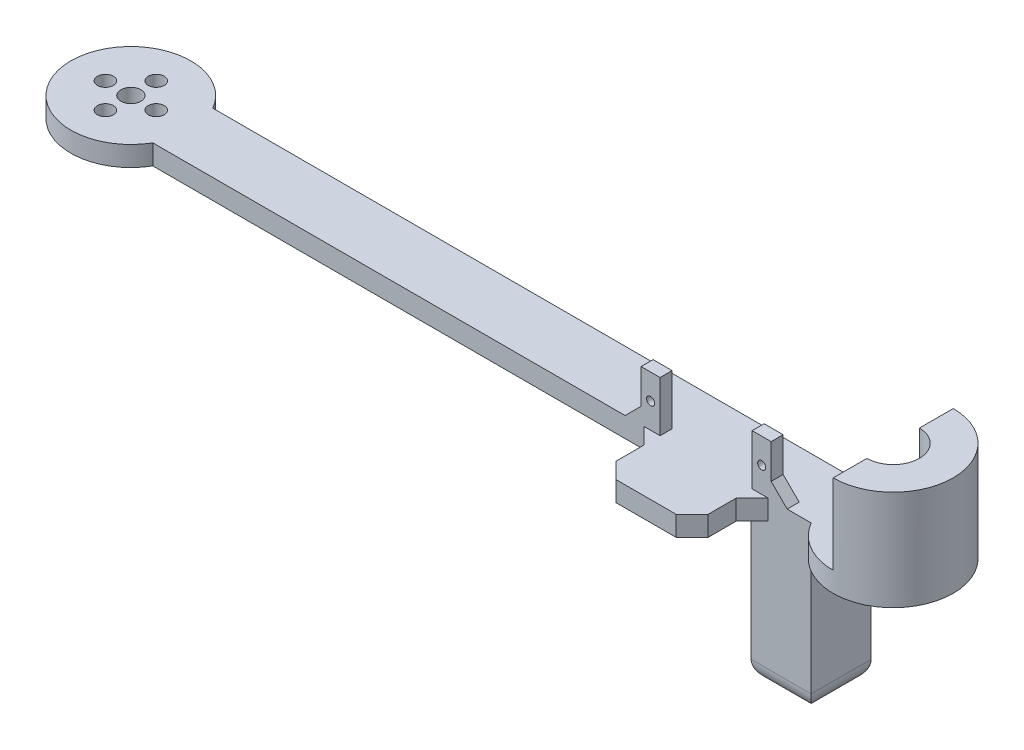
SolidWorks part; units mm, degrees
ref_plane "Front Plane" through (0, 0, 0) normal (0, 0, 1) x (1, 0, 0)
ref_plane "Top Plane" through (0, 0, 0) normal (0, 1, 0) x (1, 0, 0)
ref_plane "Right Plane" through (0, 0, 0) normal (1, 0, 0) x (0, 0, -1)
sketch "Sketch1" plane through (0, 0, 0) normal (0, 1, 0) x (1, 0, 0)
  line L0 (0, 0) -> (190.5, 0)
  line L1 (190.5, 0) -> (190.5, 15)
  line L2 (190.5, 15) -> (0, 15)
  line L3 (0, 15) -> (0, 0)
  dimension "D1" = 190.5
  dimension "D2" = 15
extrude "Boss-Extrude1" add sketch "Sketch1" along normal blind 5 contours L2 L3 L0 L1
sketch "Sketch2" plane through (0, 5, 0) normal (0, 1, 0) x (1, 0, 0)
  line L0 (190.5, 0) -> (190.5, 15) construction
  line L1 (0, 15) -> (0, 0) construction
  circle A0 centre (190.5, 7.5) radius 15
  circle A1 centre (0, 7.5) radius 15
  dimension "D1" = 30
  dimension "D2" = 30
extrude "Boss-Extrude2" add sketch "Sketch2" against normal blind 5
sketch "Sketch4" plane through (0, 5, 0) normal (0, 1, 0) x (1, 0, 0)
  circle A0 centre (0, 7.5) radius 2.5
  circle A1 centre (190.5, 7.5) radius 6.55
  dimension "D1" = 5
  dimension "D2" = 13.1
extrude "Cut-Extrude1" cut sketch "Sketch4" against normal through all
sketch "Sketch5" plane through (0, 5, 0) normal (0, 1, 0) x (1, 0, 0)
  line L0 (177.5096, 15) -> (167.5096, 15) construction
  line L1 (177.5096, 15) -> (12.9904, 15) construction
  line L2 (12.9904, 0) -> (177.5096, 0) construction
  line L3 (167.5096, 15) -> (135.0096, 15)
  line L4 (167.5096, 15) -> (167.5096, 0)
  line L6 (135.0096, 15) -> (135.0096, 0)
  line L7 (151.2596, 15) -> (151.2596, 0) construction
  line L8 (139.7596, 0) -> (135.0096, 0)
  line L9 (162.7596, 0) -> (139.7596, 0)
  line L10 (162.7596, 0) -> (162.7596, 15)
  line L11 (162.7596, 15) -> (139.7596, 15)
  line L12 (139.7596, 0) -> (139.7596, 15)
  line L13 (162.7596, 0) -> (139.7596, 15) construction
  line L14 (162.7596, 15) -> (139.7596, 0) construction
  line L15 (162.7596, 0) -> (167.5096, 0)
  line L16 (167.5096, 15) -> (162.7596, 15)
  line L17 (139.7596, 15) -> (135.0096, 15)
  line L18 (170.0778, 0) -> (170.0778, 3) construction
  line L19 (167.5096, 3) -> (162.7596, 3)
  line L21 (139.7596, 3) -> (135.0096, 3)
  point P12 (151.2596, 7.5)
  dimension "D1" = 10
  dimension "D2" = 32.5
  dimension "D3" = 23
  dimension "D4" = 3
extrude "Boss-Extrude3" add sketch "Sketch5" along normal blind 12.6 contours L12 L21 L6 M11 | L4 L19 L10 M11
sketch "Sketch7" plane through (0, 0, 0) normal (0, 0, 1) x (1, 0, 0)
  line L0 (135.0096, 5) -> (139.7596, 5) construction
  line L1 (162.7596, 5) -> (167.5096, 5) construction
  line L2 (165.1346, 5) -> (165.1346, 17.6) construction
  line L3 (162.7596, 17.6) -> (167.5096, 17.6) construction
  line L4 (137.3846, 5) -> (137.3846, 17.6) construction
  line L5 (135.0096, 17.6) -> (139.7596, 17.6) construction
  circle A0 centre (137.3846, 11.3) radius 1
  circle A1 centre (165.1346, 11.3) radius 1
  dimension "D1" = 2
  dimension "D2" = 2
extrude "Cut-Extrude2" cut sketch "Sketch7" against normal blind 12.6
sketch "Sketch8" plane through (0, 0, 0) normal (0, 0, 1) x (1, 0, 0)
  line L0 (12.9904, 0) -> (177.5096, 0) construction
  line L1 (139.7596, 5) -> (162.7596, 5)
  line L2 (139.7596, 5) -> (139.7596, 0)
  line L3 (139.7596, 0) -> (162.7596, 0)
  line L4 (162.7596, 5) -> (162.7596, 0)
extrude "Boss-Extrude4" add sketch "Sketch8" along normal blind 15
sketch "Sketch9" plane through (0, 5, 0) normal (0, 1, 0) x (1, 0, 0)
  line L0 (190.5, -11.1445) -> (190.5, 26.1445) construction
  line L1 (190.5, 14.05) -> (190.5, 22.5)
  line L2 (190.5, -7.5) -> (190.5, 0.95)
  line L14 (162.7596, 3) -> (167.5096, 3)
  line L15 (167.5096, 3) -> (167.5096, 0)
  line L16 (167.5096, 0) -> (177.5096, 0)
  line L17 (177.5096, 15) -> (12.9904, 15)
  line L18 (12.9904, 0) -> (135.0096, 0)
  line L19 (167.5096, 3) -> (167.5096, 0)
  line L20 (135.0096, 3) -> (139.7596, 3)
  line L21 (139.7596, 3) -> (139.7596, 0)
  line L22 (135.0096, 0) -> (135.0096, 3)
  line L23 (139.7596, 0) -> (139.7596, -15)
  line L24 (139.7596, -15) -> (162.7596, -15)
  line L25 (162.7596, -15) -> (162.7596, 0)
  line L26 (135.0096, 0) -> (135.0096, 3)
  line L27 (162.7596, 0) -> (162.7596, 3)
  line L28 (162.7596, 3) -> (167.5096, 3)
  line L30 (167.5096, 0) -> (177.5096, 0)
  line L31 (177.5096, 15) -> (12.9904, 15)
  line L32 (12.9904, 0) -> (135.0096, 0)
  line L34 (135.0096, 3) -> (139.7596, 3)
  line L35 (139.7596, 3) -> (139.7596, 0)
  line L37 (139.7596, 0) -> (139.7596, -15)
  line L38 (139.7596, -15) -> (162.7596, -15)
  line L39 (162.7596, -15) -> (162.7596, 0)
  line L41 (162.7596, 0) -> (162.7596, 3)
  circle A0 centre (190.5, 7.5) radius 6.55 construction
  arc A4 (190.5, 0.95) -> (190.5, 14.05) centre (190.5, 7.5) ccw
  arc A9 (177.5096, 0) -> (177.5096, 15) centre (190.5, 7.5) ccw
  arc A10 (12.9904, 15) -> (12.9904, 0) centre (0, 7.5) ccw
  arc A13 (190.5, -7.5) -> (190.5, 22.5) centre (190.5, 7.5) ccw
  arc A14 (12.9904, 15) -> (12.9904, 0) centre (0, 7.5) ccw
  point P15 (190.5, 7.5)
  dimension "D1" = 0
extrude "Boss-Extrude5" add sketch "Sketch9" along normal blind 20 contours L2 L1 M22 M38
sketch "Sketch10" plane through (0, 0, 0) normal (0, -1, 0) x (1, 0, 0)
  line L0 (177.5096, -15) -> (12.9904, -15) construction
  line L1 (177.5096, 0) -> (162.5096, 0)
  line L2 (177.5096, 0) -> (177.5096, -15)
  line L3 (177.5096, -15) -> (162.5096, -15)
  line L4 (162.5096, 0) -> (162.5096, -15)
  dimension "D1" = 15
extrude "Boss-Extrude6" add sketch "Sketch10" along normal blind 37
fillet "Fillet3" radius 5 4 edges at (170.0096, -37, -15) (162.5096, -37, -7.5) (170.0096, -37, 0) (177.5096, -37, -7.5)
sketch "Sketch11" plane through (0, 5, 0) normal (0, 1, 0) x (1, 0, 0)
  circle A0 centre (0, 7.5) radius 6.35 construction
  circle A1 centre (0, 13.85) radius 2
  circle A2 centre (6.35, 7.5) radius 2
  circle A3 centre (0, 1.15) radius 2
  circle A4 centre (-6.35, 7.5) radius 2
  dimension "D1" = 12.7
  dimension "D2" = 4
  dimension "D3" = 4
  dimension "D4" = 4
  dimension "4" = 4
extrude "Cut-Extrude3" cut sketch "Sketch11" against normal blind 47
fillet "Chamfer1" radius 4 6 edges at (139.7596, 2.5, 15) (162.7596, 2.5, 15) (162.7596, 2.5, 0) (139.7596, 2.5, 0) (135.0096, 5, -1.5) (167.5096, 5, -1.5)
